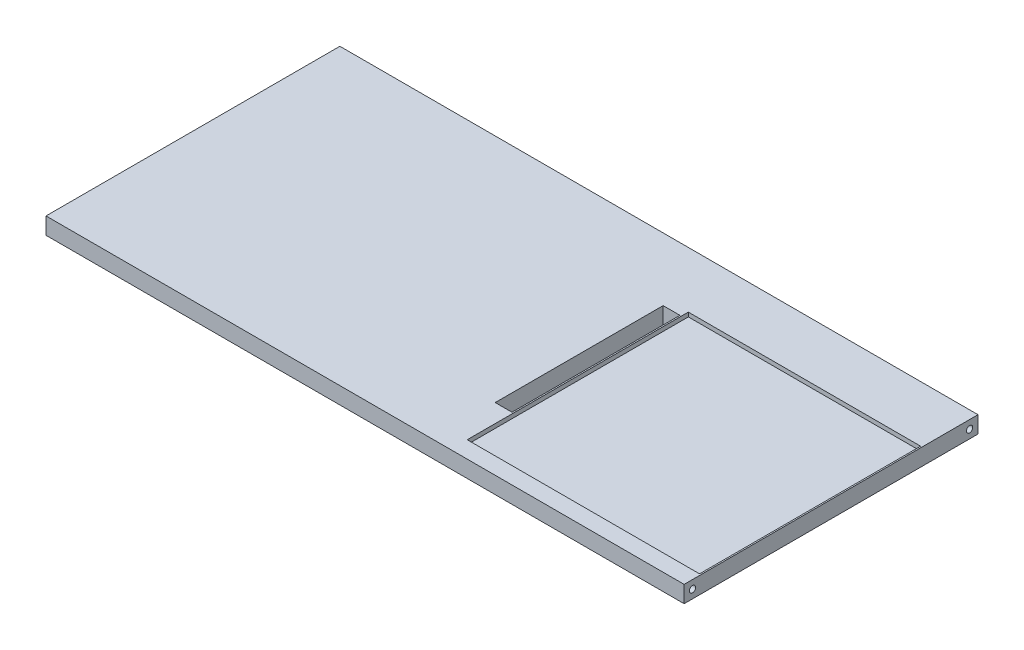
SolidWorks part; units mm, degrees
ref_plane "Front Plane" through (0, 0, 0) normal (0, 0, 1) x (1, 0, 0)
ref_plane "Top Plane" through (0, 0, 0) normal (0, 1, 0) x (1, 0, 0)
ref_plane "Right Plane" through (0, 0, 0) normal (1, 0, 0) x (0, 0, -1)
body saved out of another part "Stock-Donut Shop-1"
hole_wizard "CBORE for M4 Pan Head Machine Screw" positions "3DSketch1" profile "Sketch1" counterbore size "M4" standard "ANSI Metric"
sketch3d "3DSketch1"
  point P0 (-240, 216, -84)
  point P3 (-240, 47, -99)
  point P6 (-240, 6, -99)
  point P9 (-240, 47, 99)
  point P12 (-240, 6, 99)
sketch "Sketch1" plane through (-240, 216, -84) normal (0, 1, 0) x (0, 0, 1)
  line L0 (0, 0) -> (0, 30)
  line L1 (0, 30) -> (2.25, 28.6481)
  line L2 (2.25, 28.6481) -> (2.25, 3.1)
  line L3 (2.25, 3.1) -> (4.5, 3.1)
  line L4 (4.5, 3.1) -> (4.5, 0)
  line L5 (4.5, 0) -> (0, 0)
  line L6 (0, 30) -> (-2.25, 28.6481) construction
  line L7 (0, -6.35) -> (0, 107.95) construction
  dimension "Hole Dia." = 4.5
  dimension "Hole Depth" = 30
  dimension "C'Bore Dia." = 9
  dimension "C'Bore Depth" = 3.1
  dimension "Drill Angle" = 118
hole_wizard "CBORE for M4 Pan Head Machine Screw2" positions "3DSketch3" profile "Sketch3" counterbore size "M4" standard "ANSI Metric"
sketch3d "3DSketch3"
  point P0 (240, 256, 99)
  point P3 (240, 256, -81)
  point P6 (240, 47, 99)
  point P9 (240, 6, 99)
  point P12 (240, 6, -99)
sketch "Sketch3" plane through (240, 256, 99) normal (0, 1, 0) x (0, 0, -1)
  line L0 (0, 0) -> (0, 30)
  line L1 (0, 30) -> (2.25, 28.6481)
  line L2 (2.25, 28.6481) -> (2.25, 3.1)
  line L3 (2.25, 3.1) -> (4.5, 3.1)
  line L4 (4.5, 3.1) -> (4.5, 0)
  line L5 (4.5, 0) -> (0, 0)
  line L6 (0, 30) -> (-2.25, 28.6481) construction
  line L7 (0, -6.35) -> (0, 107.95) construction
  dimension "Hole Dia." = 4.5
  dimension "Hole Depth" = 30
  dimension "C'Bore Dia." = 9
  dimension "C'Bore Depth" = 3.1
  dimension "Drill Angle" = 118
